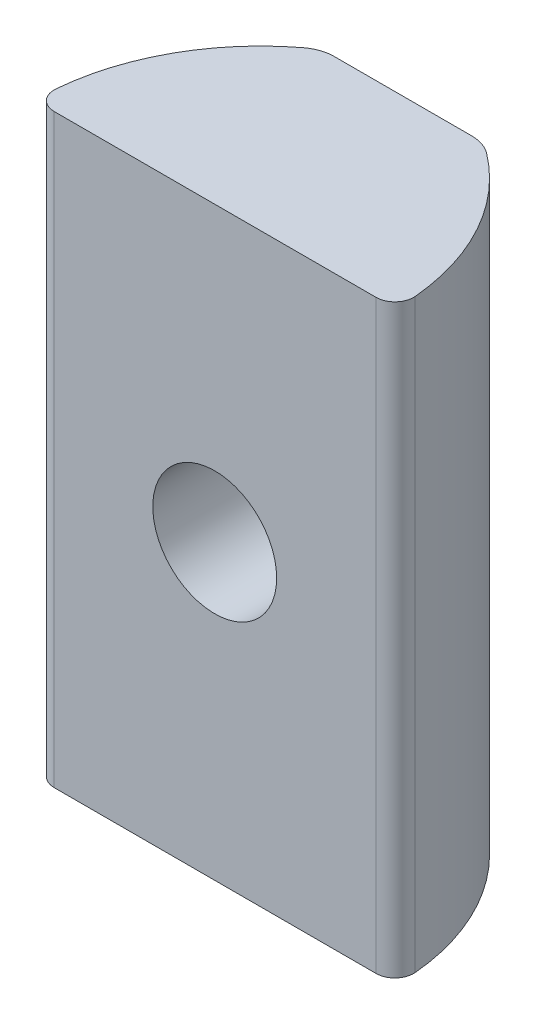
SolidWorks part; units mm, degrees
ref_plane "正面" through (0, 0, 0) normal (0, 0, 1) x (1, 0, 0)
ref_plane "平面" through (0, 0, 0) normal (0, 1, 0) x (1, 0, 0)
ref_plane "右側面" through (0, 0, 0) normal (1, 0, 0) x (0, 0, -1)
sketch "ｽｹｯﾁ1" plane through (0, 0, 0) normal (0, -1, 0) x (1, 0, 0)
  line L8 (-4.2884, 0) -> (4.2884, 0)
  line L9 (1.8306, -5) -> (-1.8306, -5)
  arc A8 (-4.7865, -0.544) -> (-2.4348, -4.7969) centre (1.1902, -0.0157) ccw
  arc A9 (-2.4348, -4.7969) -> (-1.8306, -5) centre (-1.8306, -4) ccw
  arc A10 (-4.2884, 0) -> (-4.7865, -0.544) centre (-4.2884, -0.5) ccw
  arc A11 (2.4348, -4.7969) -> (4.7865, -0.544) centre (-1.1902, -0.0157) ccw
  arc A12 (1.8306, -5) -> (2.4348, -4.7969) centre (1.8306, -4) ccw
  arc A13 (4.7865, -0.544) -> (4.2884, 0) centre (4.2884, -0.5) ccw
extrude "押し出し1" add sketch "ｽｹｯﾁ1" along normal mid plane 15.6
hole_wizard "M4x0.7 ねじ穴1" positions "ｽｹｯﾁ3" profile "ｽｹｯﾁ2" tap size "M4x0.7" standard "JIS"
sketch "ｽｹｯﾁ3" plane through (1.3374, 5.2145, 0) normal (0, 0, 1) x (1, 0, 0)
  line L1 (2.951, -13.0145) -> (-5.6258, -13.0145) construction
  line L3 (2.951, -13.0145) -> (2.951, 2.5855) construction
  point P0 (-1.349, -5.2145)
  dimension "D1" = 7.8
  dimension "D2" = 4.3
sketch "ｽｹｯﾁ2" plane through (-0.0116, 0, 0) normal (1, 0, 0) x (0, -1, 0)
  line L0 (0, 0) -> (0, 5)
  line L1 (0, 5) -> (1.65, 5)
  line L2 (1.65, 5) -> (1.65, 0)
  line L5 (1.65, 0) -> (0, 0)
  line L11 (0, -6.35) -> (0, 107.95) construction
  dimension "通孔螺纹孔钻头直径" = 3.3
  dimension "通孔螺纹孔钻头深度" = 5
